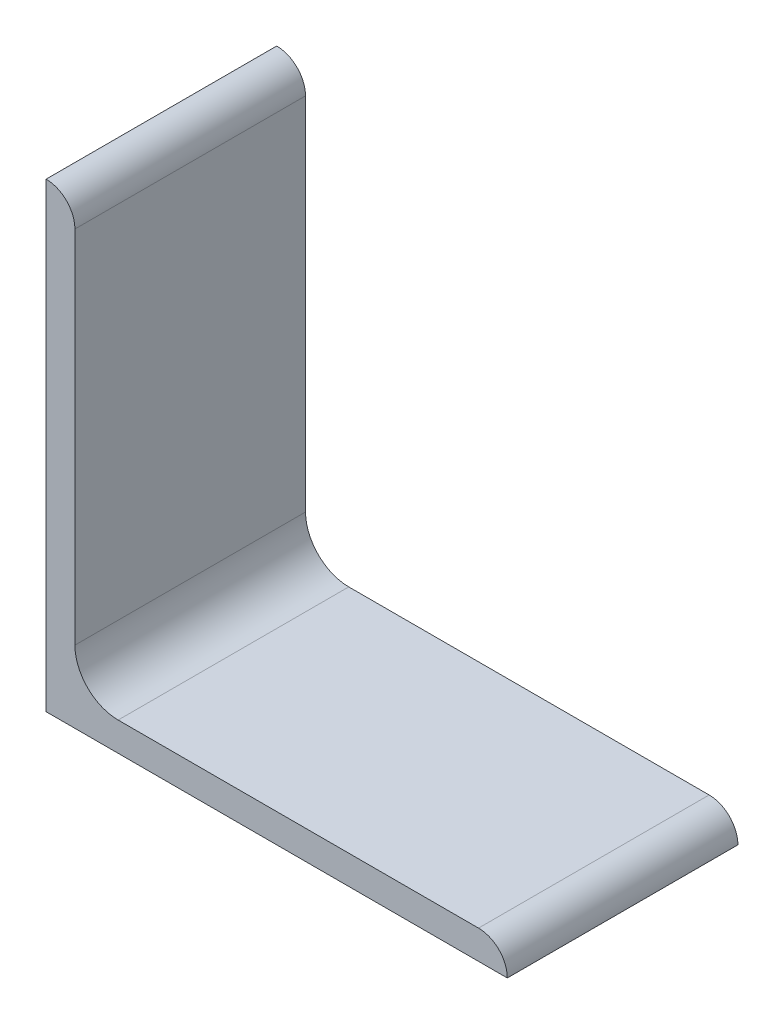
SolidWorks part; units mm, degrees
ref_plane "Plane1" through (0, 0, 0) normal (0, 0, 1) x (1, 0, 0)
ref_plane "Plane2" through (0, 0, 0) normal (0, 1, 0) x (1, 0, 0)
ref_plane "Plane3" through (0, 0, 0) normal (1, 0, 0) x (0, 0, -1)
sketch "Sketch1" plane through (0, 0, 0) normal (0, 0, 1) x (1, 0, 0)
  line L0 (0, 0) -> (0, 50.8)
  line L1 (0, 50.8) -> (0.0051, 50.8)
  line L2 (3.175, 47.6301) -> (3.175, 7.9375)
  line L3 (7.9375, 3.175) -> (47.6301, 3.175)
  line L4 (50.8, 0.0051) -> (50.8, 0)
  line L5 (50.8, 0) -> (0, 0)
  arc A0 (50.8, 0.0051) -> (47.6301, 3.175) centre (47.6301, 0.0051) ccw
  arc A1 (0.0051, 50.8) -> (3.175, 47.6301) centre (0.0051, 47.6301) cw
  arc A2 (7.9375, 3.175) -> (3.175, 7.9375) centre (7.9375, 7.9375) cw
  circle A3 centre (0, 0) radius 3.175 construction
  dimension "D2" = 0.0051
  dimension "Radius_1" = 4.7625
  dimension "Radius_2" = 3.175
  dimension "D1" = 3.175
  dimension "V_leg" = 50.8
  dimension "H_leg" = 50.8
  dimension "Thickness" = 3.175
  dimension "Flat_wid" = 0.0051
extrude "BaseSteelAngle" add sketch "Sketch1" along normal mid plane 25.4
equation "\"Flat_wid@Sketch1\" = ((sgn(\"Thickness@Sketch1\" - \"Radius_2@Sketch1\") +1)*(\"Thickness@Sketch1\" - \"Radius_2@Sketch1\"))/2 +0.0002"
equation "\"D1@Sketch1\" = \"Thickness@Sketch1\""
equation "\"D2@Sketch1\" = \"Flat_wid@Sketch1\""
